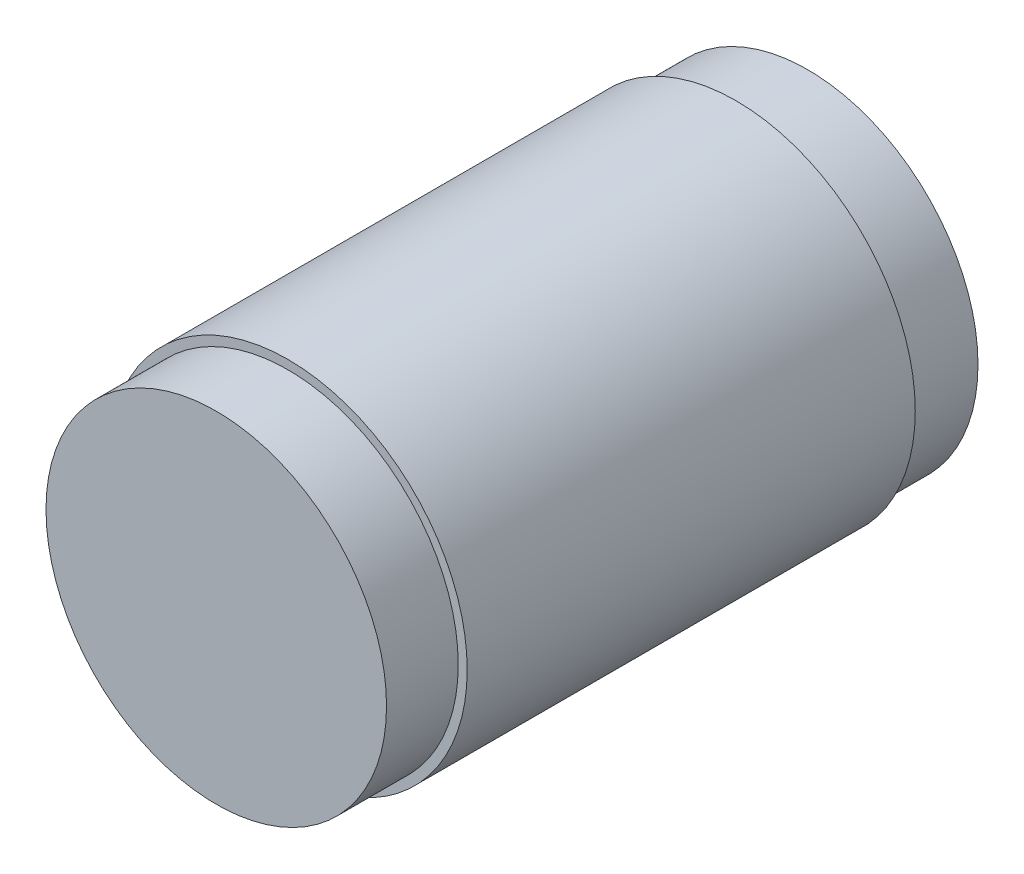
SolidWorks part; units mm, degrees
ref_plane "Front Plane" through (0, 0, 0) normal (0, 0, 1) x (1, 0, 0)
ref_plane "Top Plane" through (0, 0, 0) normal (0, 1, 0) x (1, 0, 0)
ref_plane "Right Plane" through (0, 0, 0) normal (1, 0, 0) x (0, 0, -1)
sketch "Sketch1" plane through (0, 0, 0) normal (1, 0, 0) x (0, 0, -1)
  line L0 (-33.6234, -8.7825) -> (-0.6234, -8.7825)
  line L1 (-29.6234, 1.2175) -> (-4.6234, 1.2175)
  line L2 (-17.1234, -8.7825) -> (-0.6234, -8.7825) construction
  line L3 (-33.6234, 0.7175) -> (-33.6234, -8.7825)
  line L4 (-4.6234, 1.2175) -> (-4.6234, 0.7175)
  line L5 (-0.6234, -8.7825) -> (-0.6234, 0.7175) construction
  line L6 (-29.6234, 0.7175) -> (-33.6234, 0.7175)
  line L7 (-4.6234, 0.7175) -> (-0.6234, 0.7175)
  line L8 (-29.6234, 1.2175) -> (-29.6234, 0.7175)
  line L10 (-0.6234, 0.7175) -> (-0.6234, -8.7825)
revolve "Revolve1" add sketch "Sketch1" angle 360 about L0
sketch "Sketch2" plane through (0, 0, 33.6234) normal (0, 0, 1) x (1, 0, 0)
  line L1 (-30.5, -20.7825) -> (99.5, -20.7825)
  line L3 (-30.5, -20.7825) -> (-30.5, 3.2175)
  line L4 (-30.5, 3.2175) -> (99.5, 3.2175)
  line L5 (99.5, -20.7825) -> (99.5, 3.2175)
extrude "Boss-Extrude1" [suppressed] add sketch "Sketch2" along normal blind 3
sketch "Sketch3" [suppressed] plane through (0, 0, 33.6234) normal (0, 0, -1) x (-1, 0, 0)
  line L0 (30.5, -8.7825) -> (24.5, -8.7825) construction
  line L1 (30.5, 3.2175) -> (30.5, -20.7825) construction
  line L2 (-34.5, -20.7825) -> (-34.5, 3.2175) construction
  line L3 (30.5, -20.7825) -> (-99.5, -20.7825) construction
  line L4 (-99.5, 3.2175) -> (30.5, 3.2175) construction
  line L5 (24.5, -8.7825) -> (19.5, -8.7825) construction
  circle A0 centre (19.5, -8.7825) radius 5
extrude "Boss-Extrude2" [suppressed] add sketch "Sketch3" along normal blind 3
ref_plane "Plane1" [suppressed] through (0, 3.2175, 0) normal (0, 1, 0) x (1, 0, 0)
ref_plane "Plane2" [suppressed] through (0, -8.7825, 0) normal (0, 1, 0) x (1, 0, 0)
sketch "Sketch4" [suppressed] plane through (0, -8.7825, 0) normal (0, 1, 0) x (1, 0, 0)
  line L0 (-24.5, -30.6234) -> (-23.5, -30.6234) construction
  line L1 (-14.5, -30.6234) -> (-24.5, -30.6234) construction
  line L2 (-14.5, -30.6234) -> (-15.5, -30.6234) construction
  line L5 (-23.5, -30.6234) -> (-23.5, -29.0365)
  line L6 (-23.5, -29.0365) -> (-15.5, -29.0365)
  line L7 (-15.5, -30.6234) -> (-15.5, -29.0365)
  arc A0 (-23.5, -30.6234) -> (-15.5, -30.6234) centre (-19.5, -26.6234) ccw
  dimension "D1" = 5.6569
  dimension "D2" = 1
  dimension "D3" = 1
extrude "Cut-Extrude1" [suppressed] cut sketch "Sketch4" against normal mid plane 2
ref_plane "Plane3" [suppressed] through (-30.5, 0, 0) normal (-1, 0, 0) x (0, 0, 1)
ref_plane "Plane4" [suppressed] through (34.5, 0, 0) normal (-1, 0, 0) x (0, 0, 1)
mirror "Mirror1" [suppressed] about plane through (34.5, 0, 0) normal (-1, 0, 0)
